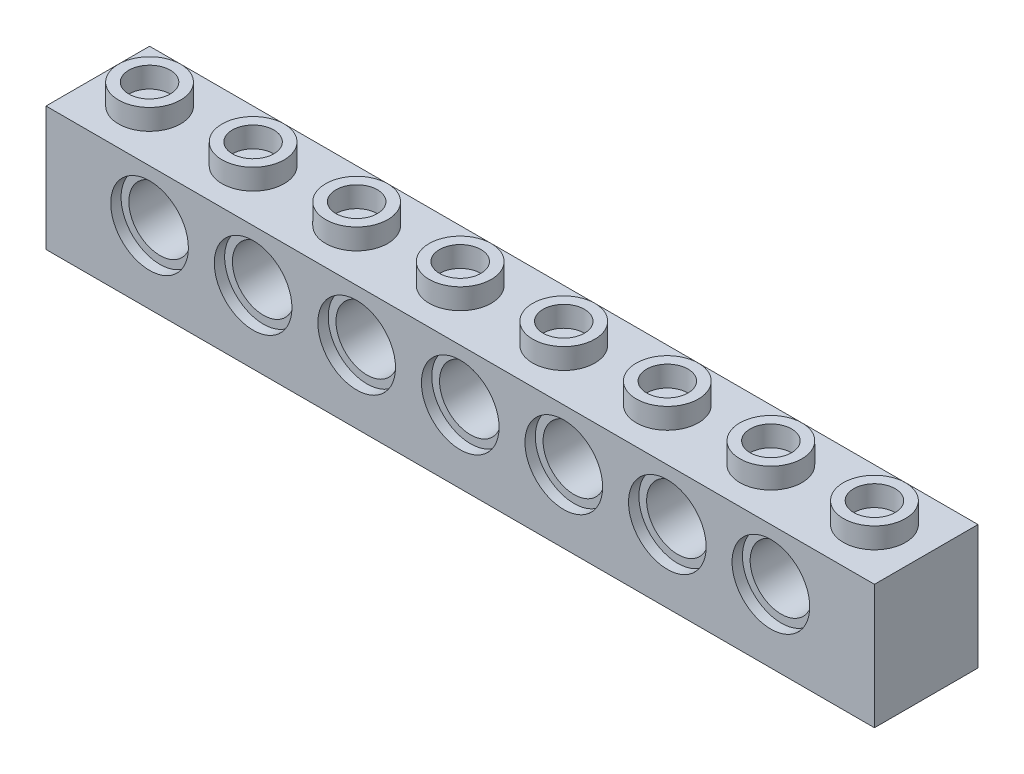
SolidWorks part; units mm, degrees
ref_plane "Front Plane" through (0, 0, 0) normal (0, 0, 1) x (1, 0, 0)
ref_plane "Top Plane" through (0, 0, 0) normal (0, 1, 0) x (1, 0, 0)
ref_plane "Right Plane" through (0, 0, 0) normal (1, 0, 0) x (0, 0, -1)
sketch "Sketch1" plane through (0, 0, 0) normal (0, 1, 0) x (1, 0, 0)
  line L1 (-32, -4) -> (32, -4)
  line L2 (-32, -4) -> (-32, 4)
  line L3 (-32, 4) -> (32, 4)
  line L4 (32, -4) -> (32, 4)
  line L5 (-32, -4) -> (32, 4) construction
  line L6 (-32, 4) -> (32, -4) construction
  point P0 (0, 0)
  dimension "D1" = 64
  dimension "D2" = 8
extrude "Boss-Extrude1" add sketch "Sketch1" along normal blind 9.6
sketch "Sketch2" plane through (0, 0, 4) normal (0, 0, 1) x (1, 0, 0)
  line L1 (-32, 9.6) -> (32, 9.6) construction
  circle A0 centre (0, 5.6) radius 2.4
  circle A1 centre (8, 5.6) radius 2.4
  circle A2 centre (16, 5.6) radius 2.4
  circle A3 centre (24, 5.6) radius 2.4
  circle A4 centre (-8, 5.6) radius 2.4
  circle A5 centre (-16, 5.6) radius 2.4
  circle A6 centre (-24, 5.6) radius 2.4
  dimension "D1" = 4.8
  dimension "D2" = 4
  dimension "D3" = 4
  dimension "D4" = 4
extrude "Cut-Extrude1" cut sketch "Sketch2" against normal through all
shell "Shell1" thickness 1.6
sketch "Sketch4" plane through (0, 0, 4) normal (0, 0, 1) x (1, 0, 0)
  circle A0 centre (-24, 5.6) radius 3
  circle A1 centre (-16, 5.6) radius 3
  circle A2 centre (-8, 5.6) radius 3
  circle A3 centre (0, 5.6) radius 3
  circle A4 centre (8, 5.6) radius 3
  circle A5 centre (16, 5.6) radius 3
  circle A6 centre (24, 5.6) radius 3
  dimension "D1" = 6
  dimension "D2" = 7
extrude "Cut-Extrude2" cut sketch "Sketch4" against normal blind 0.8
mirror "Mirror1" about plane through (0, 0, 0) normal (0, 0, 1) of "Cut-Extrude2"
sketch "Sketch5" plane through (0, 9.6, 0) normal (0, 1, 0) x (1, 0, 0)
  line L0 (-32, 4) -> (-32, -4) construction
  line L1 (32, 4) -> (-32, 4) construction
  circle A0 centre (-28, 0) radius 2.4
  circle A1 centre (-20, 0) radius 2.4
  circle A2 centre (-12, 0) radius 2.4
  circle A3 centre (-4, 0) radius 2.4
  circle A4 centre (4, 0) radius 2.4
  circle A5 centre (12, 0) radius 2.4
  circle A6 centre (20, 0) radius 2.4
  circle A7 centre (28, 0) radius 2.4
  circle A8 centre (-28, 0) radius 1.6
  circle A9 centre (-20, 0) radius 1.6
  circle A10 centre (-12, 0) radius 1.6
  circle A11 centre (-4, 0) radius 1.6
  circle A12 centre (4, 0) radius 1.6
  circle A13 centre (12, 0) radius 1.6
  circle A14 centre (20, 0) radius 1.6
  circle A15 centre (28, 0) radius 1.6
  dimension "D1" = 4.8
  dimension "D2" = 4
  dimension "D3" = 4
  dimension "D5" = 3.2
  dimension "D4" = 8
  dimension "D6" = 8
extrude "Boss-Extrude2" add sketch "Sketch5" along normal blind 1.6
sketch "Sketch6" plane through (0, 0, 0) normal (0, -1, 0) x (1, 0, 0)
  line L0 (-32, -4) -> (-32, 4) construction
  line L1 (32, -4) -> (-32, -4) construction
  circle A0 centre (-24, 0) radius 1.6
  circle A1 centre (-16, 0) radius 1.6
  circle A2 centre (-8, 0) radius 1.6
  circle A3 centre (0, 0) radius 1.6
  circle A4 centre (8, 0) radius 1.6
  circle A5 centre (16, 0) radius 1.6
  circle A6 centre (24, 0) radius 1.6
  dimension "D1" = 3.2
  dimension "D2" = 8
  dimension "D3" = 4
  dimension "D4" = 7
extrude "Boss-Extrude3" add sketch "Sketch6" against normal up to body separate body
